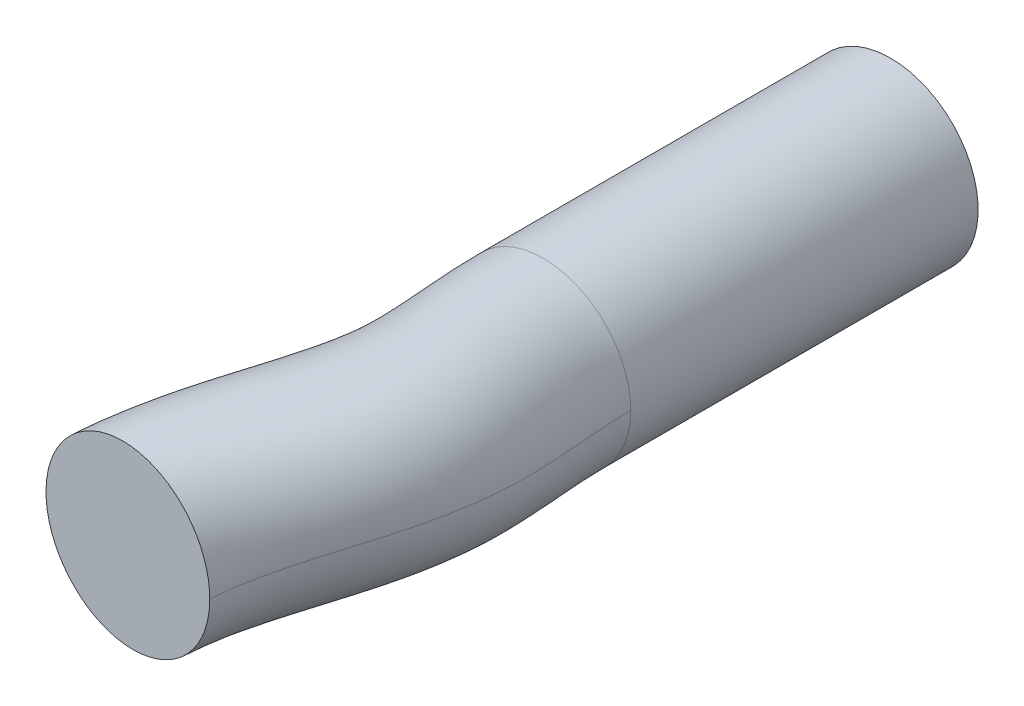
SolidWorks part; units mm, degrees
ref_plane "Front Plane" through (0, 0, 0) normal (0, 0, 1) x (1, 0, 0)
ref_plane "Top Plane" through (0, 0, 0) normal (0, 1, 0) x (1, 0, 0)
ref_plane "Right Plane" through (0, 0, 0) normal (1, 0, 0) x (0, 0, -1)
imported_body "Imported3"
sketch "Sketch1" plane through (0, 0, 11.8686) normal (0, 0, -1) x (-1, 0, 0)
  circle A0 centre (0, 0) radius 3
extrude "Boss-Extrude1" add sketch "Sketch1" along normal blind 11.8686
